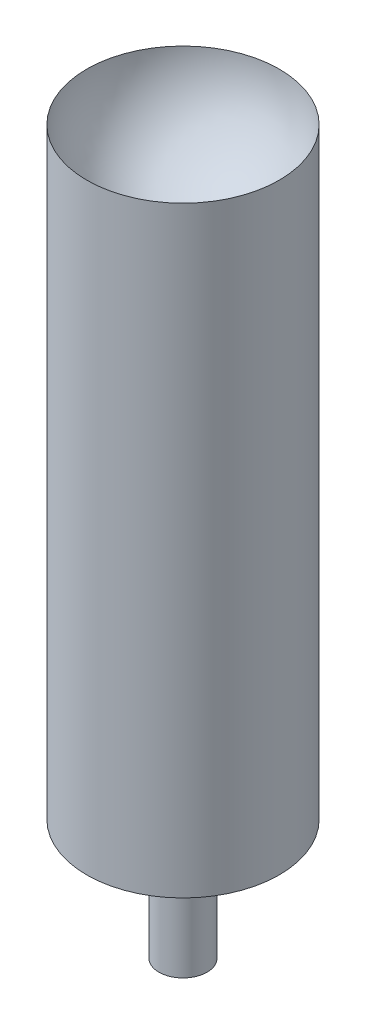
SolidWorks part; units mm, degrees
ref_plane "Front Plane" through (0, 0, 0) normal (0, 0, 1) x (1, 0, 0)
ref_plane "Top Plane" through (0, 0, 0) normal (0, 1, 0) x (1, 0, 0)
ref_plane "Right Plane" through (0, 0, 0) normal (1, 0, 0) x (0, 0, -1)
sketch "Sketch1" plane through (0, 0, 0) normal (0, 0, 1) x (1, 0, 0)
  line L0 (0, 0) -> (2, 0)
  line L1 (2, 0) -> (2, 10)
  line L2 (2, 10) -> (8, 10)
  line L3 (8, 10) -> (8, 60)
  line L4 (0, 60) -> (0, 0) construction
  line L5 (0, 60) -> (8, 60) construction
  line L6 (0, 0) -> (0, 52)
  arc A0 (0, 52) -> (8, 60) centre (0, 60) ccw
  dimension "D1" = 2
  dimension "D2" = 6
  dimension "D3" = 10
  dimension "D4" = 50
revolve "Revolve1" add sketch "Sketch1" angle 360 about L6
